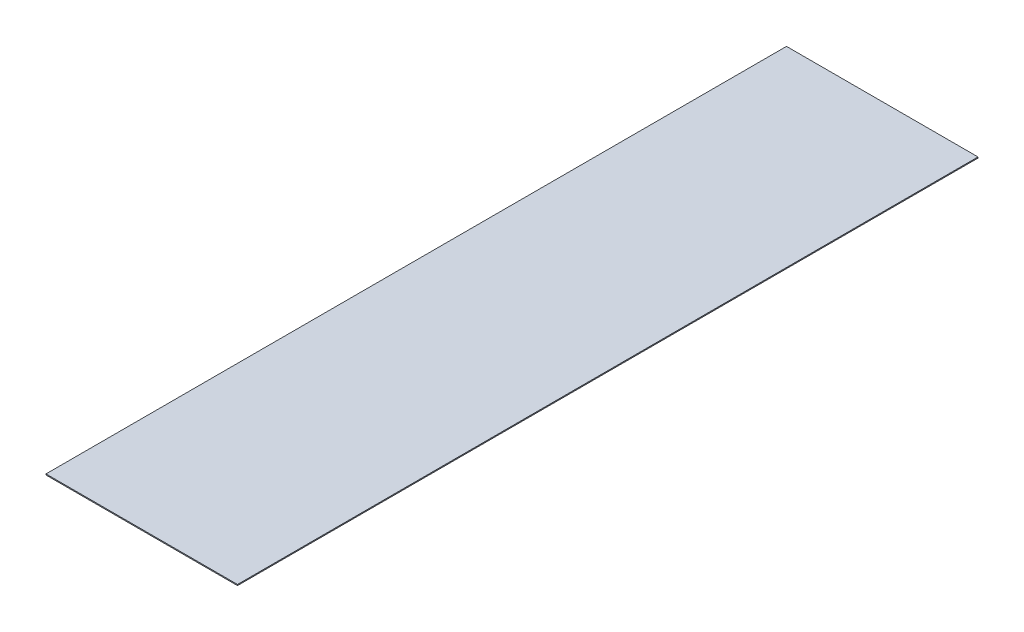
SolidWorks part; units mm, degrees
ref_plane "Front Plane" through (0, 0, 0) normal (0, 0, 1) x (1, 0, 0)
ref_plane "Top Plane" through (0, 0, 0) normal (0, 1, 0) x (1, 0, 0)
ref_plane "Right Plane" through (0, 0, 0) normal (1, 0, 0) x (0, 0, -1)
sketch "Sketch1" plane through (0, 0, 0) normal (0, 1, 0) x (1, 0, 0)
  line L5 (19.05, -76.2) -> (66.675, -76.2)
  line L6 (19.05, -76.2) -> (19.05, 107.95)
  line L7 (19.05, 107.95) -> (66.675, 107.95)
  line L8 (66.675, -76.2) -> (66.675, 107.95)
  dimension "D1" = 184.15
extrude "Boss-Extrude1" add sketch "Sketch1" along normal blind 0.254
